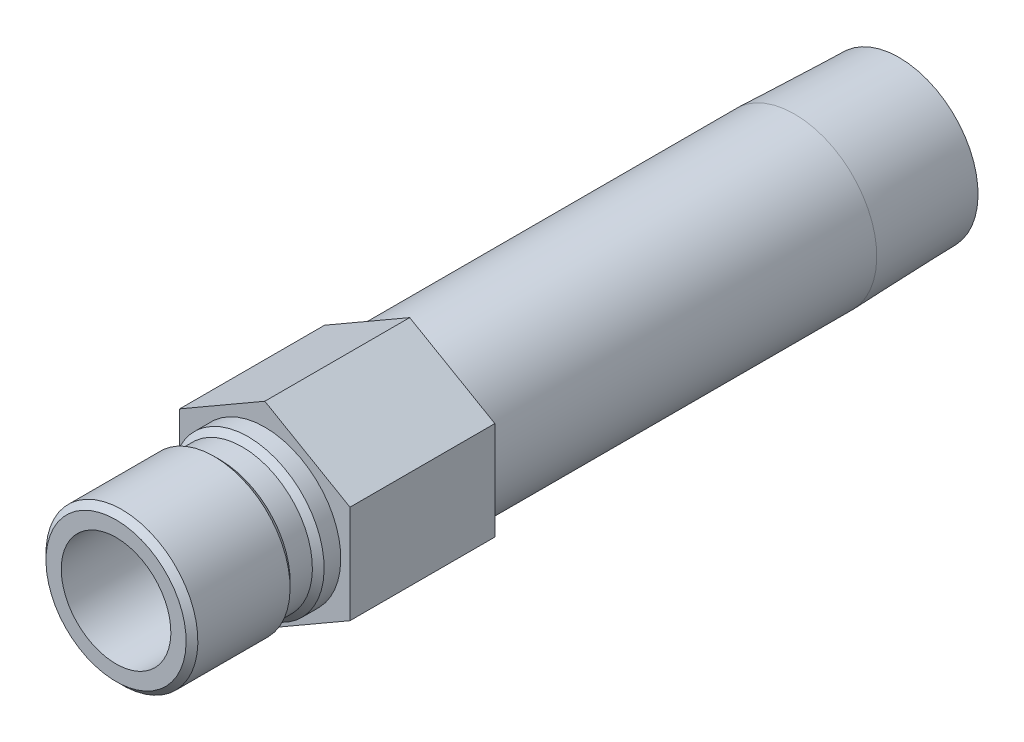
SolidWorks part; units mm, degrees
ref_plane "Front Plane" through (0, 0, 0) normal (0, 0, 1) x (1, 0, 0)
ref_plane "Top Plane" through (0, 0, 0) normal (0, 1, 0) x (1, 0, 0)
ref_plane "Right Plane" through (0, 0, 0) normal (1, 0, 0) x (0, 0, -1)
sketch "Sketch1" plane through (0, 0, 0) normal (1, 0, 0) x (0, 0, -1)
  line L0 (0, 0) -> (-22.479, 0) construction
  line L1 (-19.304, 7.112) -> (-19.304, 9.0932)
  line L2 (-5.8166, 9.0932) -> (-5.8166, 0) construction
  line L3 (-18.542, 9.8552) -> (-6.5786, 9.8552)
  line L4 (0, 10.668) -> (0, 0) construction
  line L5 (-5.8166, 9.0932) -> (-2.921, 9.0932)
  line L6 (-2.159, 9.8552) -> (0, 9.8552)
  line L7 (0, 9.8552) -> (0, 10.668)
  line L8 (-5.8166, 9.0932) -> (-6.5786, 9.8552)
  line L9 (-2.921, 9.0932) -> (-2.159, 9.8552)
  line L10 (-19.304, 9.0932) -> (-18.542, 9.8552)
  line L11 (-19.304, 7.112) -> (-1.524, 7.112)
  line L12 (0, 10.668) -> (68.7324, 10.668)
  line L13 (68.7324, 10.668) -> (82.296, 10.2441)
  line L14 (82.296, 10.2441) -> (82.296, 7.8994)
  line L15 (0, 9.8552) -> (18.796, 9.8552) construction
  line L16 (18.796, 9.8552) -> (18.796, 0) construction
  line L17 (18.796, 0) -> (0, 0) construction
  line L18 (-1.524, 7.112) -> (-1.1053, 7.8994)
  line L19 (-1.1053, 7.8994) -> (82.296, 7.8994)
  dimension "D1" = 19.304
  dimension "D2" = 2.8956
  dimension "D3" = 0.762
  dimension "D4" = 45
  dimension "D5" = 13.4874
  dimension "D6" = 45
  dimension "D7" = 1.79
  dimension "D8" = 13.5636
  dimension "D9" = 101.6
  dimension "D10" = 3.175
  dimension "D11" = 38.1
  dimension "D12" = 14.224
  dimension "D13" = 21.336
  dimension "D14" = 19.7104
  dimension "D15" = 15.7988
  dimension "D16" = 118
  dimension "D17" = 17.78
revolve "Revolve1" add sketch "Sketch1" angle 360 about L0
sketch "Sketch2" plane through (0, 0, 0) normal (0, 0, 1) x (1, 0, 0)
  line L1 (-11.049, 6.3791) -> (-11.049, -6.3791)
  line L2 (-11.049, -6.3791) -> (0, -12.7583)
  line L3 (0, -12.7583) -> (11.049, -6.3791)
  line L4 (11.049, -6.3791) -> (11.049, 6.3791)
  line L5 (11.049, 6.3791) -> (0, 12.7583)
  line L6 (0, 12.7583) -> (-11.049, 6.3791)
  circle A0 centre (0, 0) radius 11.049 construction
  circle A1 centre (0, 0) radius 7.112 construction
  circle A2 centre (0, 0) radius 7.112
  dimension "D1" = 22.098
extrude "Boss-Extrude1" add sketch "Sketch2" against normal up to vertex (18.796 mm away) from vertex at 0
